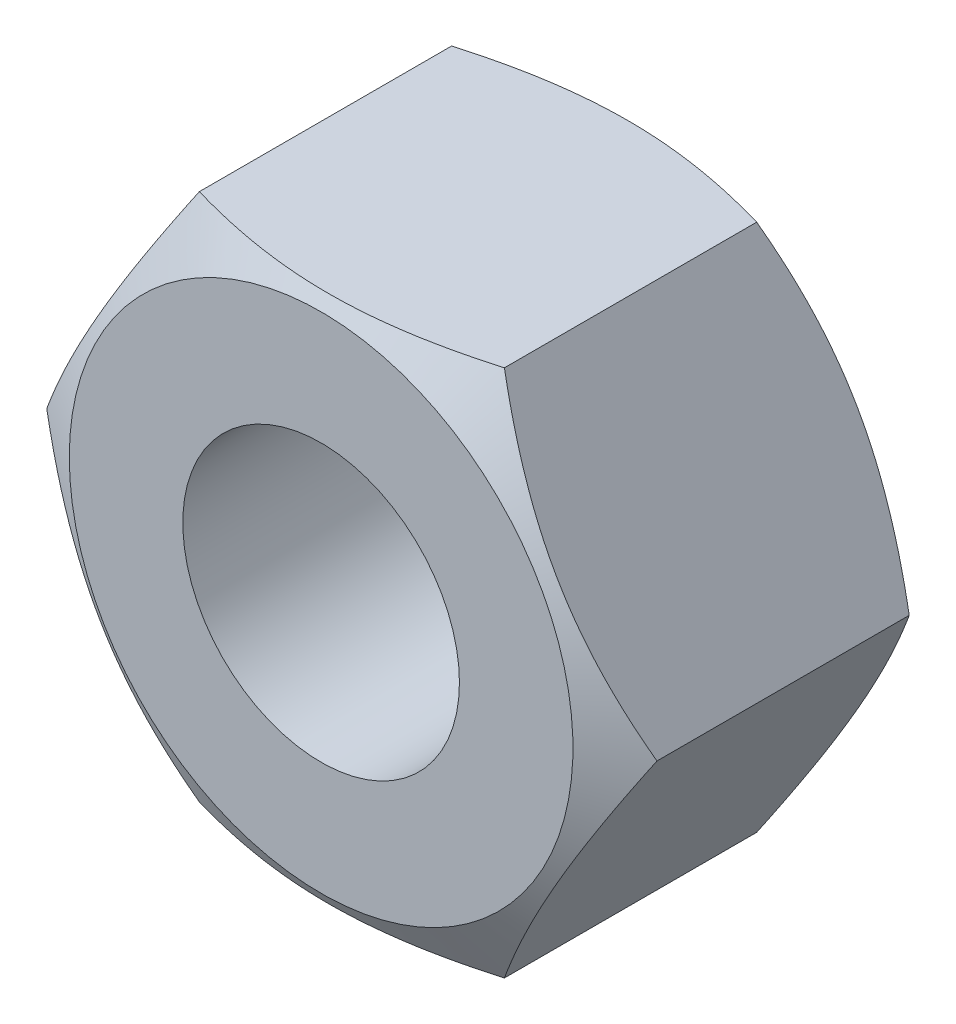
SolidWorks part; units mm, degrees
ref_plane "Front" through (0, 0, 0) normal (0, 0, 1) x (1, 0, 0)
ref_plane "Top" through (0, 0, 0) normal (0, 1, 0) x (1, 0, 0)
ref_plane "Right" through (0, 0, 0) normal (1, 0, 0) x (0, 0, -1)
sketch "Sketch1" plane through (0, 0, 0) normal (0, 0, 1) x (1, 0, 0)
  line L1 (4.6188, -8) -> (9.2376, 0)
  line L2 (9.2376, 0) -> (4.6188, 8)
  line L3 (4.6188, 8) -> (-4.6188, 8)
  line L4 (-4.6188, 8) -> (-9.2376, 0)
  line L5 (-9.2376, 0) -> (-4.6188, -8)
  line L6 (-4.6188, -8) -> (4.6188, -8)
  circle A0 centre (0, 0) radius 8 construction
  circle A1 centre (0, 0) radius 4.188
  dimension "D" = 8.376
  dimension "s" = 16
extrude "BaseNut" add sketch "Sketch1" against normal blind 9.5
sketch "Sketch2" plane through (0, 0, 0) normal (0, 1, 0) x (1, 0, 0)
  line L0 (-9.2376, 9.5) -> (-7.625, 9.5)
  line L2 (-7.625, 9.5) -> (-9.2376, 8.569)
  line L3 (-9.2376, 8.569) -> (-9.2376, 9.5)
  line L4 (0, 3.3759) -> (0, -9.8171) construction
  line L6 (-9.7712, 4.75) -> (9.8853, 4.75) construction
  line L7 (-9.2376, 0.931) -> (-9.2376, 0)
  line L8 (-7.625, 0) -> (-9.2376, 0.931)
  line L9 (-9.2376, 0) -> (-7.625, 0)
  line L10 (-9.2376, 9.5) -> (-9.2376, 0) construction
  dimension "D1" = 30
  dimension "dw" = 15.25
  dimension "D2" = 4.75
revolve "Double-Chamfer" cut sketch "Sketch2" angle 360 about L4
sketch "Sketch4" plane through (0, 0, 0) normal (0, 1, 0) x (1, 0, 0)
  line L0 (4.8912, 9.5) -> (4.188, 9.094)
  line L1 (4.188, 9.094) -> (3.376, 9.094)
  line L2 (3.376, 9.094) -> (3.376, 9.906)
  line L3 (3.376, 9.906) -> (4.188, 9.906)
  line L4 (4.188, 9.906) -> (4.8912, 9.5)
  line L5 (0, 0) -> (0, 109.7681) construction
  dimension "D1" = 0.812
  dimension "D2" = 8.376
revolve "Cut-Revolve10" [suppressed] cut sketch "Sketch4" angle 360 about L5
pattern_linear "LPattern10" [suppressed] count 11 spacing 0.9744 along (0, 0, -1)
equation "\"dw@Sketch2\" = \"s@Sketch1\"-0.75"
equation "\"D2@Sketch2\" = \"m@BaseNut\" / 2"
equation "\"D2@Sketch4\"=\"D@Sketch1\""
equation "\"D1@Sketch4\" =  (\"D@ThreadCosmetic1\" - \"D2@Sketch4\"  )  / 2"
equation "\"D3@LPattern10\" = \"D1@Sketch4\" * 1.2"
equation "\"D1@LPattern10\" = \"m@BaseNut\" / \"D3@LPattern10\" + 1"
